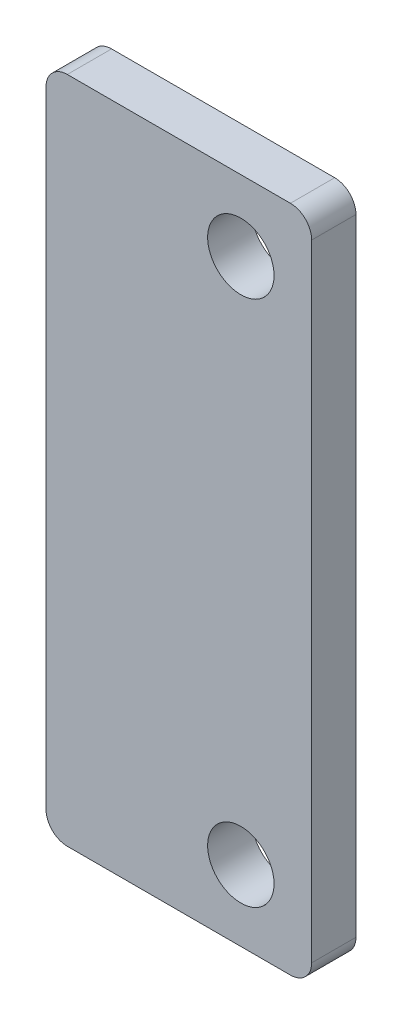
SolidWorks part; units mm, degrees
ref_plane "Front" through (0, 0, 0) normal (0, 0, 1) x (1, 0, 0)
ref_plane "Top" through (0, 0, 0) normal (0, 1, 0) x (1, 0, 0)
ref_plane "Right" through (0, 0, 0) normal (1, 0, 0) x (0, 0, -1)
sketch "Sketch1" plane through (0, 0, 0) normal (0, 0, 1) x (1, 0, 0)
  line L0 (-620.7125, 175.5775) -> (-620.7125, -177.165) construction
  line L1 (-620.4585, 150.495) -> (-604.4565, 150.495)
  line L2 (-621.9825, 152.019) -> (-621.9825, 196.9135)
  line L3 (-620.4585, 198.4375) -> (-604.4565, 198.4375)
  line L4 (-602.9325, 152.019) -> (-602.9325, 196.9135)
  line L5 (-452.12, 149.225) -> (-744.22, 149.225) construction
  line L6 (-965.2, 180.6575) -> (-625.7925, 180.6575) construction
  arc A0 (-604.4565, 150.495) -> (-602.9325, 152.019) centre (-604.4565, 152.019) ccw
  arc A1 (-621.9825, 196.9135) -> (-620.4585, 198.4375) centre (-620.4585, 196.9135) cw
  arc A2 (-604.4565, 198.4375) -> (-602.9325, 196.9135) centre (-604.4565, 196.9135) cw
  arc A3 (-620.4585, 150.495) -> (-621.9825, 152.019) centre (-620.4585, 152.019) cw
  dimension "D5" = 1.524
  dimension "D1" = 1.27
  dimension "D2" = 1.27
  dimension "D3" = 17.78
  dimension "D4" = 19.05
extrude "Boss-Extrude1" add sketch "Sketch1" along normal blind 3.175 separate body
hole_wizard "Hole1" positions "Point_Sketch" profile "Profil_Sketch" hole size "Ø0.15" standard "ISO"
sketch "Point_Sketch" plane through (-611.6668, 203.9586, 3.175) normal (0, 0, -1) x (1, 0, 0)
  point P0 (3.6543, 10.6011)
  point P2 (3.6543, 48.3836)
sketch "Profil_Sketch" plane through (-608.0125, 193.3575, 3.175) normal (1, 0, 0) x (0, -1, 0)
  line L0 (0, 0) -> (0, 3.175)
  line L1 (0, 3.175) -> (2.3812, 3.175)
  line L2 (2.3812, 3.175) -> (2.3813, 0)
  line L5 (2.3813, 0) -> (0, 0)
  line L11 (0, -6.35) -> (0, 107.95) construction
  dimension "Diameter" = 4.7625
  dimension "Thru Hole Depth" = 3.175
other "usin_DL090_8-32x.375-BHCS<1>"
